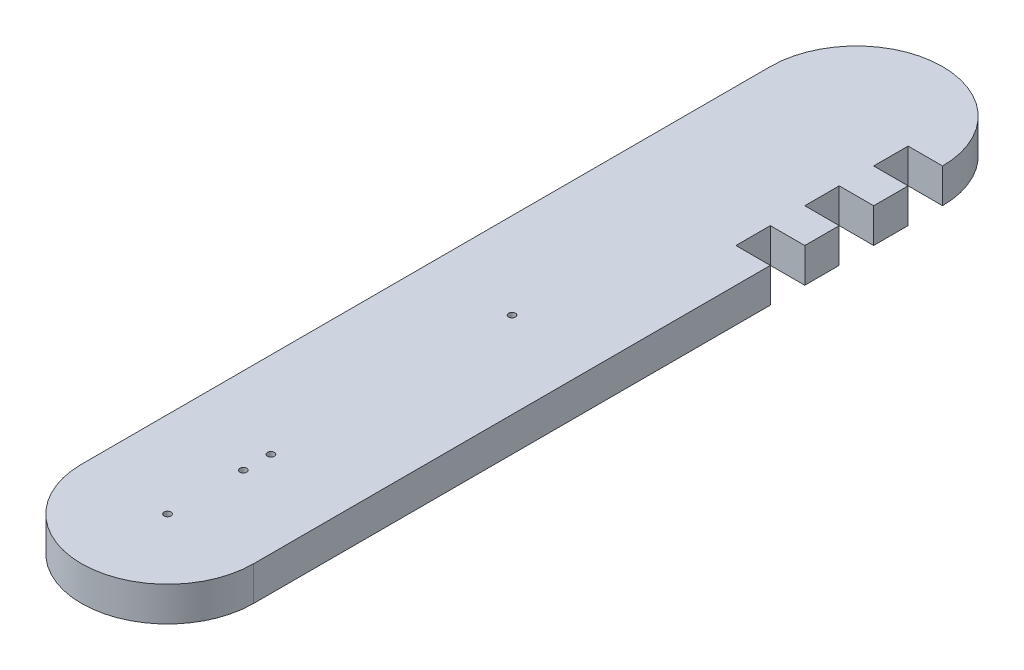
SolidWorks part; units mm, degrees
ref_plane "Front Plane" through (0, 0, 0) normal (0, 0, 1) x (1, 0, 0)
ref_plane "Top Plane" through (0, 0, 0) normal (0, 1, 0) x (1, 0, 0)
ref_plane "Right Plane" through (0, 0, 0) normal (1, 0, 0) x (0, 0, -1)
sketch "Sketch1" plane through (0, 0, 0) normal (0, 1, 0) x (1, 0, 0)
  line L0 (0, 0) -> (0, -100)
  line L2 (25, -100) -> (25, 0)
  arc A0 (25, 0) -> (0, 0) centre (12.5, 0) ccw
  arc A1 (0, -100) -> (25, -100) centre (12.5, -100) ccw
  circle A5 centre (12.5, -100) radius 0.5
  circle A6 centre (12.5, -89) radius 0.5
  circle A7 centre (12.5, -85) radius 0.5
  circle A8 centre (12.5, -50) radius 0.5
  dimension "D3" = 1
  dimension "D4" = 1
  dimension "D5" = 1
  dimension "D8" = 50
  dimension "D9" = 1
  dimension "D1" = 100
  dimension "D2" = 25
  dimension "D6" = 11
  dimension "D7" = 4
extrude "Boss-Extrude1" add sketch "Sketch1" along normal blind 5
sketch "Sketch2" plane through (0, 5, 0) normal (0, 1, 0) x (1, 0, 0)
  line L0 (25, 0) -> (20, 0)
  line L1 (20, 0) -> (20, -5)
  line L2 (20, -5) -> (25, -5)
  line L3 (25, -100) -> (25, 0) construction
  line L4 (25, -10) -> (20, -10)
  line L5 (20, -10) -> (20, -15)
  line L6 (20, -15) -> (25, -15)
  line L7 (25, -20) -> (20, -20)
  line L8 (20, -20) -> (20, -25)
  line L9 (20, -25) -> (25, -25)
  line L10 (25, -25) -> (25, -20)
  line L11 (25, -15) -> (25, -10)
  line L12 (25, -5) -> (25, 0)
  dimension "D1" = 5
  dimension "D2" = 5
  dimension "D3" = 5
  dimension "D4" = 5
  dimension "D5" = 5
  dimension "D6" = 5
  dimension "D7" = 5
  dimension "D8" = 5
extrude "Cut-Extrude1" cut sketch "Sketch2" against normal blind 5 contours L0 L1 L2 L12 | L4 L5 L6 L11 | L7 L8 L9 L10
